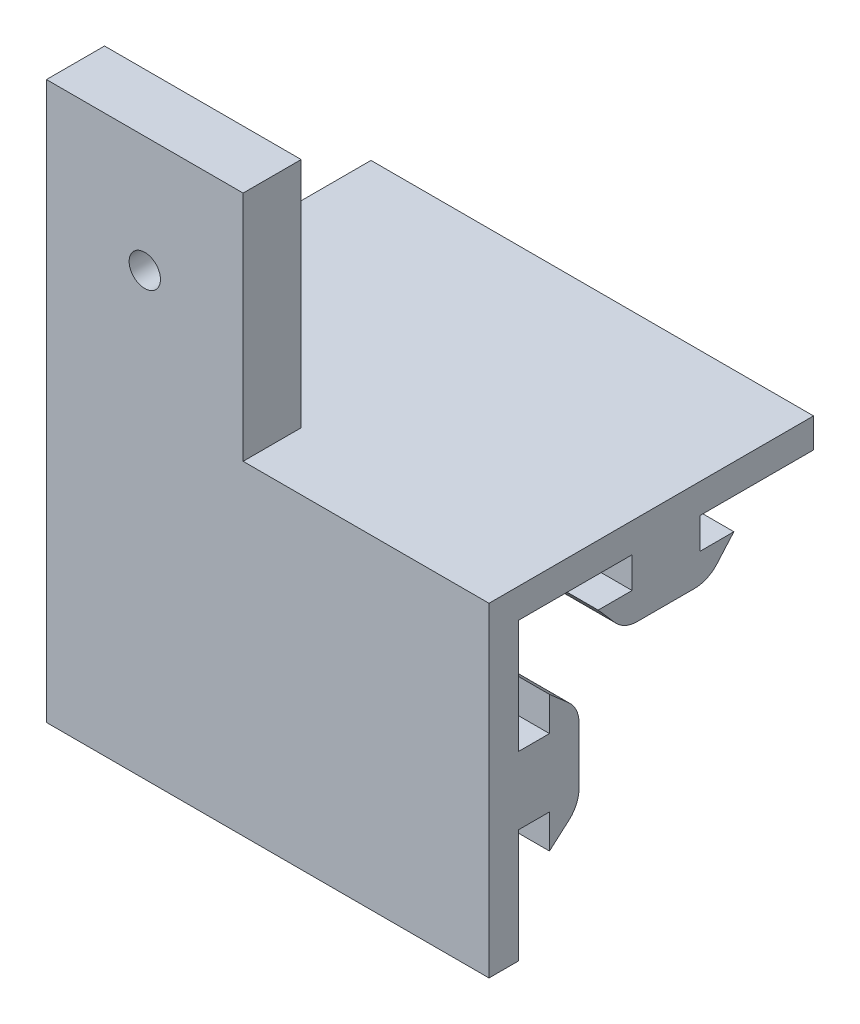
SolidWorks part; units mm, degrees
ref_plane "Front Plane" through (0, 0, 0) normal (0, 0, 1) x (1, 0, 0)
ref_plane "Top Plane" through (0, 0, 0) normal (0, 1, 0) x (1, 0, 0)
ref_plane "Right Plane" through (0, 0, 0) normal (1, 0, 0) x (0, 0, -1)
sketch "Sketch1" plane through (0, 0, 0) normal (0, 0, 1) x (1, 0, 0)
  line L1 (-41.91, -12.7) -> (41.91, -12.7)
  line L2 (-41.91, -12.7) -> (-41.91, 12.7)
  line L3 (-41.91, 12.7) -> (41.91, 12.7)
  line L4 (41.91, -12.7) -> (41.91, 12.7)
  line L5 (-41.91, -12.7) -> (41.91, 12.7) construction
  line L6 (-41.91, 12.7) -> (41.91, -12.7) construction
  point P0 (0, 0)
  dimension "D1" = 83.82
  dimension "D2" = 25.4
extrude "Boss-Extrude1" add sketch "Sketch1" along normal blind 12.7
sketch "Sketch3" plane through (0, 0, 12.7) normal (0, 0, 1) x (1, 0, 0)
  line L0 (41.91, -6.86) -> (41.91, -7.62)
  line L1 (-41.91, -6.86) -> (-41.91, -7.8218)
  line L2 (-41.4131, -6.6226) -> (-41.415, -6.71)
  line L3 (-40.3041, -6.6534) -> (-40.3058, -6.6983)
  line L6 (-40.8652, -6.1) -> (-40.8591, -6.1)
  line L7 (-38.8652, -6.1) -> (-38.8591, -6.1)
  line L12 (-39.4131, -6.6226) -> (-39.415, -6.71)
  line L13 (-38.3041, -6.6534) -> (-38.3058, -6.6983)
  line L14 (-37.4131, -6.6226) -> (-37.415, -6.71)
  line L15 (-36.8652, -6.1) -> (-36.8591, -6.1)
  line L16 (-34.8652, -6.1) -> (-34.8591, -6.1)
  line L17 (-32.8652, -6.1) -> (-32.8591, -6.1)
  line L18 (-30.8652, -6.1) -> (-30.8591, -6.1)
  line L19 (-28.8652, -6.1) -> (-28.8591, -6.1)
  line L20 (-26.8654, -6.1) -> (-26.8591, -6.1)
  line L21 (-24.8652, -6.1) -> (-24.8591, -6.1)
  line L27 (34.8591, -6.1) -> (34.8652, -6.1)
  line L28 (36.8591, -6.1) -> (36.8652, -6.1)
  line L29 (38.8591, -6.1) -> (38.8652, -6.1)
  line L30 (40.8591, -6.1) -> (40.8652, -6.1)
  line L32 (32.8652, -6.1) -> (29.456, -5.9831)
  line L33 (-41.91, -12.7) -> (41.91, -12.7) construction
  line L34 (41.91, -5.465) -> (29.4688, -5.465) construction
  line L35 (41.91, -12.7) -> (41.91, 12.7) construction
  line L38 (31.565, -7.82) -> (29.0504, -7.931)
  line L40 (-41.91, -7.8218) -> (-41.91, -8.0218)
  line L41 (-41.91, -8.0218) -> (-22.86, -8.0218)
  line L42 (-22.86, -7.8218) -> (-22.86, -8.0218)
  line L45 (31.565, -7.82) -> (41.91, -7.82)
  line L46 (41.91, -7.62) -> (41.91, -7.82)
  line L47 (22.1752, -12.7) -> (24.143, -12.7)
  line L390 (33.415, -6.6226) -> (33.4131, -6.6226)
  line L391 (33.415, -6.71) -> (33.415, -6.6226)
  line L392 (34.1562, -6.86) -> (33.565, -6.86)
  line L393 (34.3041, -6.6534) -> (34.3041, -6.6559)
  line L398 (35.415, -6.6226) -> (35.4131, -6.6226)
  line L399 (35.415, -6.71) -> (35.415, -6.6226)
  line L400 (36.1562, -6.86) -> (35.565, -6.86)
  line L401 (36.3041, -6.6534) -> (36.3041, -6.6559)
  line L406 (37.415, -6.6226) -> (37.4131, -6.6226)
  line L407 (37.415, -6.71) -> (37.415, -6.6226)
  line L408 (38.1562, -6.86) -> (37.565, -6.86)
  line L409 (38.3041, -6.6534) -> (38.3041, -6.6559)
  line L414 (39.415, -6.6226) -> (39.4131, -6.6226)
  line L415 (39.415, -6.71) -> (39.415, -6.6226)
  line L416 (40.1562, -6.86) -> (39.565, -6.86)
  line L417 (40.3041, -6.6534) -> (40.3041, -6.6559)
  line L422 (41.415, -6.6226) -> (41.4131, -6.6226)
  line L423 (41.415, -6.71) -> (41.415, -6.6226)
  line L424 (41.91, -6.86) -> (41.565, -6.86)
  line L1628 (0, -27.3539) -> (0, 27.3539) construction
  line L1698 (-41.91, -6.86) -> (-41.565, -6.86)
  line L1706 (-40.1562, -6.86) -> (-39.565, -6.86)
  line L1714 (-38.1562, -6.86) -> (-37.565, -6.86)
  line L1721 (-36.3041, -6.6534) -> (-36.3041, -6.6559)
  line L1722 (-36.1562, -6.86) -> (-35.565, -6.86)
  line L1723 (-35.415, -6.71) -> (-35.415, -6.6226)
  line L1724 (-35.415, -6.6226) -> (-35.4131, -6.6226)
  line L1729 (-34.3041, -6.6534) -> (-34.3041, -6.6559)
  line L1730 (-34.1562, -6.86) -> (-33.565, -6.86)
  line L1731 (-33.415, -6.71) -> (-33.415, -6.6226)
  line L1732 (-33.415, -6.6226) -> (-33.4131, -6.6226)
  line L1737 (-32.3041, -6.6534) -> (-32.3041, -6.6559)
  line L1738 (-32.1562, -6.86) -> (-31.565, -6.86)
  line L1739 (-31.415, -6.71) -> (-31.415, -6.6226)
  line L1740 (-31.415, -6.6226) -> (-31.4131, -6.6226)
  line L1745 (-30.3041, -6.6534) -> (-30.3041, -6.6559)
  line L1746 (-30.1562, -6.86) -> (-29.565, -6.86)
  line L1747 (-29.415, -6.71) -> (-29.415, -6.6226)
  line L1748 (-29.415, -6.6226) -> (-29.4131, -6.6226)
  line L1753 (-28.3041, -6.6534) -> (-28.3041, -6.6559)
  line L1754 (-28.1562, -6.86) -> (-27.565, -6.86)
  line L1755 (-27.415, -6.71) -> (-27.415, -6.6226)
  line L1756 (-27.415, -6.6226) -> (-27.4131, -6.6226)
  line L1761 (-26.3041, -6.6535) -> (-26.3041, -6.656)
  line L1762 (-26.1563, -6.86) -> (-25.5651, -6.8601)
  line L1763 (-25.4151, -6.7101) -> (-25.4151, -6.6226)
  line L1764 (-25.4151, -6.6226) -> (-25.4132, -6.6226)
  line L1769 (-24.3041, -6.6534) -> (-24.3041, -6.6549)
  line L1770 (-24.1562, -6.86) -> (-23.565, -6.86)
  line L1771 (-23.415, -6.71) -> (-23.415, -6.6226)
  line L1772 (-23.415, -6.6226) -> (-23.4131, -6.6226)
  line L1773 (-22.8652, -6.1) -> (-22.86, -7.3726)
  line L1774 (-22.86, -7.3726) -> (-22.86, -7.8218)
  arc A3 (29.456, -5.9831) -> (22.1752, -12.7) centre (28.9139, -12.7) ccw
  arc A5 (29.0504, -7.931) -> (24.143, -12.7) centre (28.9139, -12.7) ccw
  arc A235 (33.4131, -6.6226) -> (32.8652, -6.1) centre (32.8591, -6.655) ccw
  arc A236 (33.415, -6.71) -> (33.565, -6.86) centre (33.565, -6.71) ccw
  arc A237 (34.1562, -6.86) -> (34.3058, -6.6983) centre (34.1562, -6.71) ccw
  arc A238 (34.3041, -6.6559) -> (34.3058, -6.6983) centre (34.8591, -6.655) ccw
  arc A239 (34.8591, -6.1) -> (34.3041, -6.6534) centre (34.8591, -6.655) ccw
  arc A240 (35.4131, -6.6226) -> (34.8652, -6.1) centre (34.8591, -6.655) ccw
  arc A241 (35.415, -6.71) -> (35.565, -6.86) centre (35.565, -6.71) ccw
  arc A242 (36.1562, -6.86) -> (36.3058, -6.6983) centre (36.1562, -6.71) ccw
  arc A243 (36.3041, -6.6559) -> (36.3058, -6.6983) centre (36.8591, -6.655) ccw
  arc A244 (36.8591, -6.1) -> (36.3041, -6.6534) centre (36.8591, -6.655) ccw
  arc A245 (37.4131, -6.6226) -> (36.8652, -6.1) centre (36.8591, -6.655) ccw
  arc A246 (37.415, -6.71) -> (37.565, -6.86) centre (37.565, -6.71) ccw
  arc A247 (38.1562, -6.86) -> (38.3058, -6.6983) centre (38.1562, -6.71) ccw
  arc A248 (38.3041, -6.6559) -> (38.3058, -6.6983) centre (38.8591, -6.655) ccw
  arc A249 (38.8591, -6.1) -> (38.3041, -6.6534) centre (38.8591, -6.655) ccw
  arc A250 (39.4131, -6.6226) -> (38.8652, -6.1) centre (38.8591, -6.655) ccw
  arc A251 (39.415, -6.71) -> (39.565, -6.86) centre (39.565, -6.71) ccw
  arc A252 (40.1562, -6.86) -> (40.3058, -6.6983) centre (40.1562, -6.71) ccw
  arc A253 (40.3041, -6.6559) -> (40.3058, -6.6983) centre (40.8591, -6.655) ccw
  arc A254 (40.8591, -6.1) -> (40.3041, -6.6534) centre (40.8591, -6.655) ccw
  arc A255 (41.4131, -6.6226) -> (40.8652, -6.1) centre (40.8591, -6.655) ccw
  arc A256 (41.415, -6.71) -> (41.565, -6.86) centre (41.565, -6.71) ccw
  arc A1043 (-41.415, -6.71) -> (-41.565, -6.86) centre (-41.565, -6.71) cw
  arc A1044 (-41.4131, -6.6226) -> (-40.8652, -6.1) centre (-40.8591, -6.655) cw
  arc A1045 (-40.8591, -6.1) -> (-40.3041, -6.6534) centre (-40.8591, -6.655) cw
  arc A1047 (-40.1562, -6.86) -> (-40.3058, -6.6983) centre (-40.1562, -6.71) cw
  arc A1048 (-39.415, -6.71) -> (-39.565, -6.86) centre (-39.565, -6.71) cw
  arc A1049 (-39.4131, -6.6226) -> (-38.8652, -6.1) centre (-38.8591, -6.655) cw
  arc A1050 (-38.8591, -6.1) -> (-38.3041, -6.6534) centre (-38.8591, -6.655) cw
  arc A1052 (-38.1562, -6.86) -> (-38.3058, -6.6983) centre (-38.1562, -6.71) cw
  arc A1053 (-37.415, -6.71) -> (-37.565, -6.86) centre (-37.565, -6.71) cw
  arc A1054 (-37.4131, -6.6226) -> (-36.8652, -6.1) centre (-36.8591, -6.655) cw
  arc A1055 (-36.8591, -6.1) -> (-36.3041, -6.6534) centre (-36.8591, -6.655) cw
  arc A1056 (-36.3041, -6.6559) -> (-36.3058, -6.6983) centre (-36.8591, -6.655) cw
  arc A1057 (-36.1562, -6.86) -> (-36.3058, -6.6983) centre (-36.1562, -6.71) cw
  arc A1058 (-35.415, -6.71) -> (-35.565, -6.86) centre (-35.565, -6.71) cw
  arc A1059 (-35.4131, -6.6226) -> (-34.8652, -6.1) centre (-34.8591, -6.655) cw
  arc A1060 (-34.8591, -6.1) -> (-34.3041, -6.6534) centre (-34.8591, -6.655) cw
  arc A1061 (-34.3041, -6.6559) -> (-34.3058, -6.6983) centre (-34.8591, -6.655) cw
  arc A1062 (-34.1562, -6.86) -> (-34.3058, -6.6983) centre (-34.1562, -6.71) cw
  arc A1063 (-33.415, -6.71) -> (-33.565, -6.86) centre (-33.565, -6.71) cw
  arc A1064 (-33.4131, -6.6226) -> (-32.8652, -6.1) centre (-32.8591, -6.655) cw
  arc A1065 (-32.8591, -6.1) -> (-32.3041, -6.6534) centre (-32.8591, -6.655) cw
  arc A1066 (-32.3041, -6.6559) -> (-32.3058, -6.6983) centre (-32.8591, -6.655) cw
  arc A1067 (-32.1562, -6.86) -> (-32.3058, -6.6983) centre (-32.1562, -6.71) cw
  arc A1068 (-31.415, -6.71) -> (-31.565, -6.86) centre (-31.565, -6.71) cw
  arc A1069 (-31.4131, -6.6226) -> (-30.8652, -6.1) centre (-30.8591, -6.655) cw
  arc A1070 (-30.8591, -6.1) -> (-30.3041, -6.6534) centre (-30.8591, -6.655) cw
  arc A1071 (-30.3041, -6.6559) -> (-30.3058, -6.6983) centre (-30.8591, -6.655) cw
  arc A1072 (-30.1562, -6.86) -> (-30.3058, -6.6983) centre (-30.1562, -6.71) cw
  arc A1073 (-29.415, -6.71) -> (-29.565, -6.86) centre (-29.565, -6.71) cw
  arc A1074 (-29.4131, -6.6226) -> (-28.8652, -6.1) centre (-28.8591, -6.655) cw
  arc A1075 (-28.8591, -6.1) -> (-28.3041, -6.6534) centre (-28.8591, -6.655) cw
  arc A1076 (-28.3041, -6.6559) -> (-28.3058, -6.6983) centre (-28.8591, -6.655) cw
  arc A1077 (-28.1562, -6.86) -> (-28.3058, -6.6983) centre (-28.1562, -6.71) cw
  arc A1078 (-27.415, -6.71) -> (-27.565, -6.86) centre (-27.565, -6.71) cw
  arc A1079 (-27.4131, -6.6226) -> (-26.8654, -6.1) centre (-26.8591, -6.655) cw
  arc A1080 (-26.8591, -6.1) -> (-26.3041, -6.6535) centre (-26.8591, -6.655) cw
  arc A1081 (-26.3041, -6.656) -> (-26.3058, -6.6983) centre (-26.8591, -6.655) cw
  arc A1082 (-26.1563, -6.86) -> (-26.3058, -6.6983) centre (-26.1563, -6.71) cw
  arc A1083 (-25.4151, -6.7101) -> (-25.5651, -6.8601) centre (-25.5651, -6.7101) cw
  arc A1084 (-25.4132, -6.6226) -> (-24.8652, -6.1) centre (-24.8591, -6.655) cw
  arc A1085 (-24.8591, -6.1) -> (-24.3041, -6.6534) centre (-24.8591, -6.655) cw
  arc A1086 (-24.3041, -6.6549) -> (-24.3058, -6.6983) centre (-24.8591, -6.655) cw
  arc A1087 (-24.1562, -6.86) -> (-24.3058, -6.6983) centre (-24.1562, -6.71) cw
  arc A1088 (-23.415, -6.71) -> (-23.565, -6.86) centre (-23.565, -6.71) cw
  arc A1089 (-23.4131, -6.6226) -> (-22.8652, -6.1) centre (-22.8591, -6.655) cw
  point P24 (0, 0)
  dimension "D1" = 0.635
  dimension "D3" = 0.76
sketch "Sketch4" plane through (0, 0, 12.7) normal (0, 0, 1) x (1, 0, 0)
  line L1 (-19.05, -12.7) -> (19.05, -12.7)
  line L2 (-19.05, -12.7) -> (-19.05, 12.7)
  line L3 (-19.05, 12.7) -> (19.05, 12.7)
  line L4 (19.05, -12.7) -> (19.05, 12.7)
  line L5 (-19.05, -12.7) -> (19.05, 12.7) construction
  line L6 (-19.05, 12.7) -> (19.05, -12.7) construction
  point P0 (0, 0)
  dimension "D1" = 38.1
extrude "Boss-Extrude2" add sketch "Sketch4" along normal blind 38.1
sketch "Sketch5" plane through (0, 12.7, 0) normal (0, 1, 0) x (1, 0, 0)
  line L1 (-13.335, -45.085) -> (13.335, -45.085)
  line L2 (-13.335, -45.085) -> (-13.335, -18.415)
  line L3 (-13.335, -18.415) -> (13.335, -18.415)
  line L4 (13.335, -45.085) -> (13.335, -18.415)
  line L5 (-13.335, -45.085) -> (13.335, -18.415) construction
  line L6 (-13.335, -18.415) -> (13.335, -45.085) construction
  line L8 (-19.05, -50.8) -> (-19.05, -12.7) construction
  line L9 (19.05, -50.8) -> (-19.05, -50.8) construction
  point P0 (0, -31.75)
  point P9 (0, -31.75)
  dimension "D1" = 19.05
  dimension "D2" = 26.67
  dimension "D3" = 26.67
  dimension "D4" = 19.05
extrude "Cut-Extrude1" cut sketch "Sketch5" against normal blind 19.05
sketch "Sketch7" plane through (0, -6.35, 0) normal (0, 1, 0) x (1, 0, 0)
  line L0 (-13.335, -45.085) -> (13.335, -45.085) construction
  circle A0 centre (0, -31.75) radius 3.429
  point P0 (0, -31.75)
  dimension "D2" = 6.858
  dimension "D1" = 13.335
extrude "Cut-Extrude2" cut sketch "Sketch7" against normal through all
sketch "Sketch8" plane through (-41.91, 0, 0) normal (-1, 0, 0) x (0, 0, 1)
  line L0 (0, 12.7) -> (0, -12.7) construction
  line L2 (-5.207, 2.466) -> (-5.207, -2.466)
  line L5 (0, 2.921) -> (0, -2.921)
  line L7 (-4.3402, 4.377) -> (-2.667, 5.842)
  line L8 (-2.667, 5.842) -> (-2.667, 2.921)
  line L10 (-2.667, -5.842) -> (-2.667, -2.921)
  line L11 (-4.3402, -4.377) -> (-2.667, -5.842)
  line L12 (-2.667, 2.921) -> (0, 2.921)
  line L13 (-2.667, -2.921) -> (0, -2.921)
  arc A0 (-4.3402, 4.377) -> (-5.207, 2.466) centre (-2.667, 2.466) ccw
  arc A1 (-5.207, -2.466) -> (-4.3402, -4.377) centre (-2.667, -2.466) ccw
  point P0 (-3.937, -1.0959)
  dimension "D1" = 2.54
  dimension "D2" = 2.54
  dimension "D7" = 2.667
  dimension "D3" = 5.842
  dimension "D4" = 2.921
  dimension "D5" = 2.54
  dimension "D6" = 2.921
  dimension "D8" = 2.667
  dimension "D9" = 2.921
extrude "Boss-Extrude3" add sketch "Sketch8" against normal blind 83.82
sketch "Sketch10" plane through (41.91, 0, 0) normal (1, 0, 0) x (0, 0, -1)
  line L0 (-12.7, -12.7) -> (-12.7, 12.7) construction
  line L1 (-12.7, 7.62) -> (-4.7, 7.62)
  line L2 (-12.7, 7.62) -> (-12.7, 3.62)
  line L3 (-12.7, 3.62) -> (-4.7, 3.62)
  line L4 (-4.7, 7.62) -> (-4.7, 3.62)
  line L5 (-12.7, 12.7) -> (0, 12.7) construction
  dimension "D1" = 8
  dimension "D2" = 4
  dimension "D3" = 5.08
extrude "Cut-Extrude3" cut sketch "Sketch10" against normal through all
extrude "Cut-Extrude4" cut sketch "Sketch3" against normal blind 6
sketch "Sketch11" plane through (-41.91, 0, 0) normal (-1, 0, 0) x (0, 0, 1)
  line L0 (12.7, 12.7) -> (0, 12.7) construction
  line L1 (2.54, 12.7) -> (50.8, 12.7)
  line L2 (2.54, 12.7) -> (2.54, -12.7)
  line L3 (2.54, -12.7) -> (50.8, -12.7)
  line L4 (50.8, 12.7) -> (50.8, -12.7)
  line L5 (0, 12.7) -> (0, 2.921) construction
  dimension "D1" = 2.54
extrude "Cut-Extrude5" cut sketch "Sketch11" against normal through all
sketch "Sketch12" plane through (0, 0, 2.54) normal (0, 0, 1) x (1, 0, 0)
  line L0 (41.91, 12.7) -> (-41.91, 12.7) construction
  line L1 (8.89, 12.7) -> (41.91, 12.7)
  line L2 (8.89, 12.7) -> (8.89, -12.7)
  line L3 (8.89, -12.7) -> (41.91, -12.7)
  line L4 (41.91, 12.7) -> (41.91, -12.7)
  line L5 (-41.91, 12.7) -> (-41.91, -12.7) construction
  dimension "D1" = 50.8
extrude "Cut-Extrude6" cut sketch "Sketch12" against normal through all
ref_plane "Plane1" through (0, 6.35, -6.35) normal (0, -0.7071, 0.7071) x (-1, 0, 0)
sketch "Sketch14" plane through (0, 12.7, 0) normal (0, 1, 0) x (1, 0, 0)
  line L1 (-41.91, 0) -> (8.89, 0)
  line L2 (-41.91, 0) -> (-41.91, -2.54)
  line L3 (-41.91, -2.54) -> (8.89, -2.54)
  line L4 (8.89, 0) -> (8.89, -2.54)
extrude "Boss-Extrude4" add sketch "Sketch14" along normal blind 2.54
mirror "Mirror4" about plane through (0, 6.35, -6.35) normal (0, -0.7071, 0.7071)
sketch "Sketch16" plane through (0, 15.24, 0) normal (0, 1, 0) x (1, 0, 0)
  line L1 (-41.91, -2.54) -> (-12.28, -2.54)
  line L2 (-41.91, -2.54) -> (-41.91, 2.46)
  line L3 (-41.91, 2.46) -> (-12.28, 2.46)
  line L4 (-12.28, -2.54) -> (-12.28, 2.46)
  dimension "D1" = 5
  dimension "D2" = 29.63
extrude "Boss-Extrude5" add sketch "Sketch16" along normal blind 20
sketch "Sketch18" plane through (0, 0, 2.54) normal (0, 0, 1) x (1, 0, 0)
  line L0 (-41.91, 35.24) -> (-12.28, 35.24) construction
  line L1 (-41.91, -12.7) -> (-29.21, -12.7)
  line L2 (-41.91, -12.7) -> (-41.91, 35.24)
  line L3 (-41.91, 35.24) -> (-29.21, 35.24)
  line L4 (-29.21, -12.7) -> (-29.21, 35.24)
  dimension "D1" = 12.7
extrude "Cut-Extrude8" cut sketch "Sketch18" against normal through all
sketch "Sketch19" plane through (0, 0, 2.54) normal (0, 0, 1) x (1, 0, 0)
  line L0 (-29.21, 35.24) -> (-12.28, 35.24) construction
  line L2 (-12.28, 35.24) -> (-12.28, 15.24) construction
  circle A0 centre (-20.745, 25.24) radius 1.35
  dimension "D1" = 2.7
  dimension "D2" = 10
  dimension "D3" = 8.465
extrude "Cut-Extrude9" cut sketch "Sketch19" against normal through all
